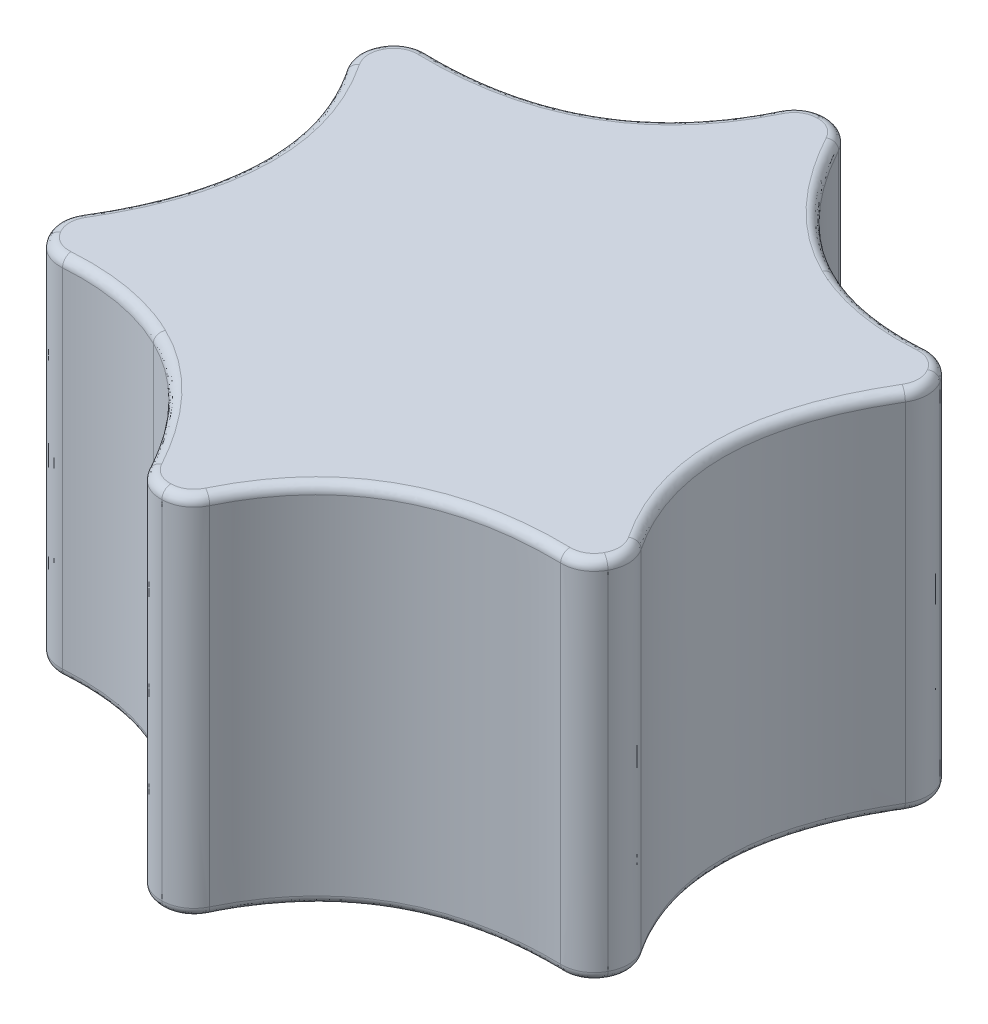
SolidWorks part; units mm, degrees
ref_plane "Front Plane" through (0, 0, 0) normal (0, 0, 1) x (1, 0, 0)
ref_plane "Top Plane" through (0, 0, 0) normal (0, 1, 0) x (1, 0, 0)
ref_plane "Right Plane" through (0, 0, 0) normal (1, 0, 0) x (0, 0, -1)
body saved out of another part "Stock-Wooden Clock Video-1"
fillet "Fillet1" radius 0.5 40 edges
